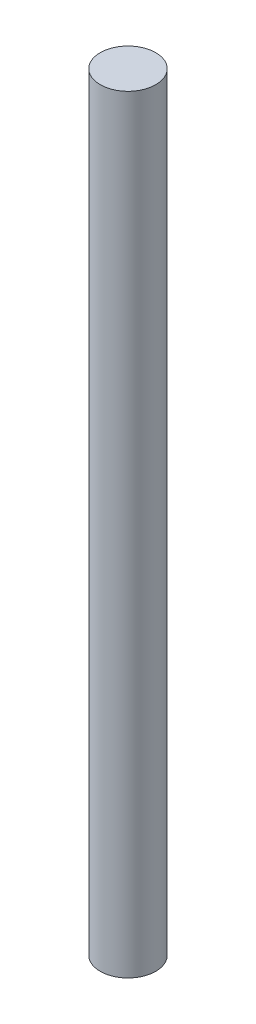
SolidWorks part; units mm, degrees
ref_plane "Plan de face" through (0, 0, 0) normal (0, 0, 1) x (1, 0, 0)
ref_plane "Plan de dessus" through (0, 0, 0) normal (0, 1, 0) x (1, 0, 0)
ref_plane "Plan de droite" through (0, 0, 0) normal (1, 0, 0) x (0, 0, -1)
sketch "Esquisse1" plane through (0, 0, 0) normal (0, 1, 0) x (1, 0, 0)
  circle A0 centre (0, 0) radius 3
  dimension "D1" = 6
extrude "Extrusion1" add sketch "Esquisse1" along normal blind 83
